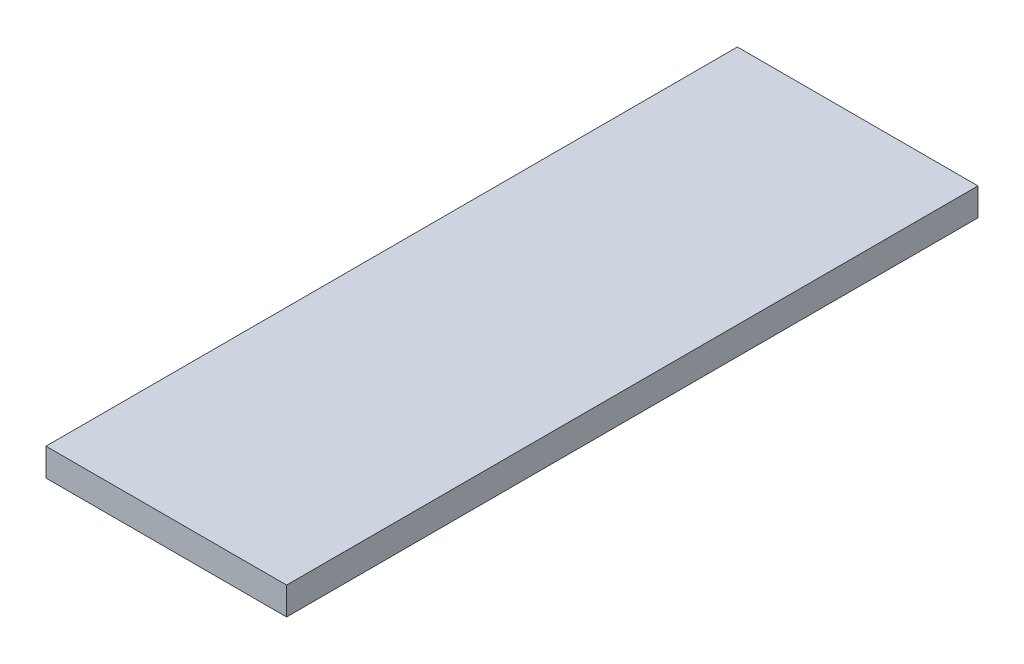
SolidWorks part; units mm, degrees
ref_plane "Front Plane" through (0, 0, 0) normal (0, 0, 1) x (1, 0, 0)
ref_plane "Top Plane" through (0, 0, 0) normal (0, 1, 0) x (1, 0, 0)
ref_plane "Right Plane" through (0, 0, 0) normal (1, 0, 0) x (0, 0, -1)
sketch "Sketch1" plane through (0, 0, 0) normal (0, 1, 0) x (1, 0, 0)
  line L1 (-12.9724, -15.9103) -> (-4.2724, -15.9103)
  line L2 (-12.9724, -15.9103) -> (-12.9724, 9.0897)
  line L3 (-12.9724, 9.0897) -> (-4.2724, 9.0897)
  line L4 (-4.2724, -15.9103) -> (-4.2724, 9.0897)
  dimension "D1" = 8.7
  dimension "D2" = 25
extrude "Boss-Extrude1" add sketch "Sketch1" along normal blind 1
